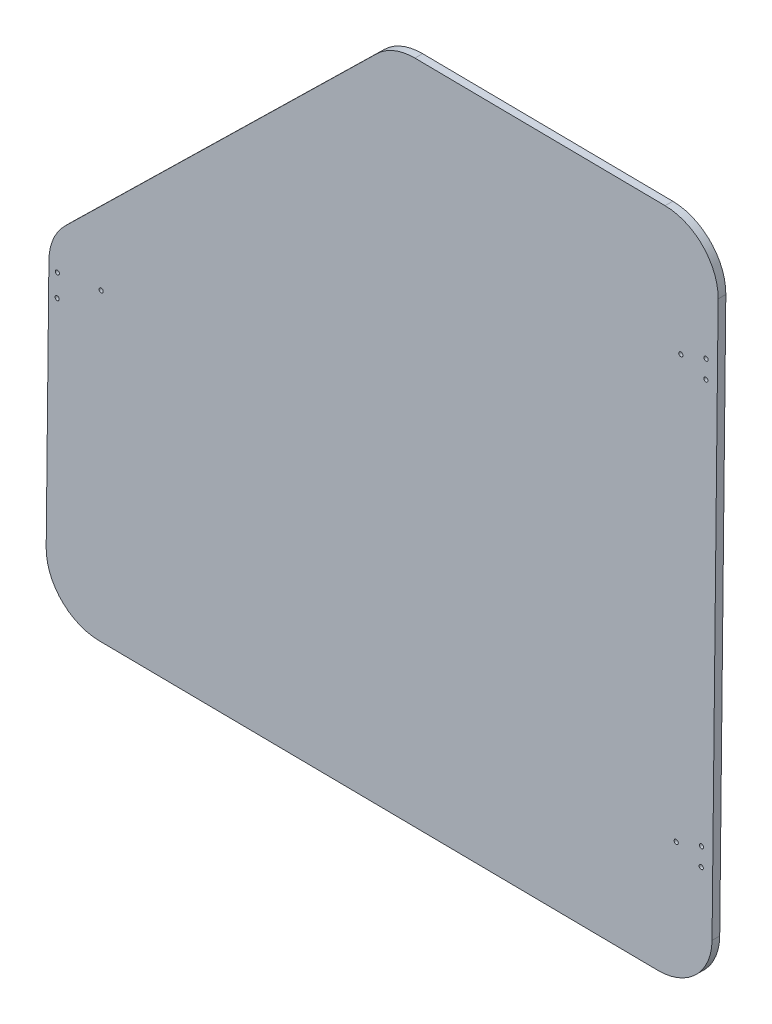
SolidWorks part; units mm, degrees
ref_plane "Front Plane" through (0, 0, 0) normal (0, 0, 1) x (1, 0, 0)
ref_plane "Top Plane" through (0, 0, 0) normal (0, 1, 0) x (1, 0, 0)
ref_plane "Right Plane" through (0, 0, 0) normal (1, 0, 0) x (0, 0, -1)
sketch "Sketch1" plane through (0, 0, 0) normal (0, 0, 1) x (1, 0, 0)
  line L60 (-704.4479, 303.9144) -> (-707.5589, 19.5107)
  line L61 (-331.7296, 693.5453) -> (-686.1227, 346.8217)
  line L62 (-4.028, 707.8164) -> (-288.4317, 710.9275)
  line L63 (49.3158, 11.2313) -> (56.2616, 646.1933)
  line L64 (-647.2694, -42.1125) -> (-12.3074, -49.0583)
  arc A60 (-707.5589, 19.5107) -> (-647.2694, -42.1125) centre (-646.6026, 18.8439) ccw
  arc A61 (-686.1227, 346.8217) -> (-704.4479, 303.9144) centre (-643.4915, 303.2476) ccw
  arc A62 (-288.4317, 710.9275) -> (-331.7296, 693.5453) centre (-289.0985, 649.9711) ccw
  arc A63 (56.2616, 646.1933) -> (-4.028, 707.8164) centre (-4.6948, 646.8601) ccw
  arc A64 (-12.3074, -49.0583) -> (49.3158, 11.2313) centre (-11.6406, 11.8981) ccw
extrude "Boss-Extrude1" add sketch "Sketch1" against normal up to surface (8.7313 mm away)
sketch "Sketch2" plane through (0, 0, 0) normal (0, 0, 1) x (1, 0, 0)
  line L21 (-645.0528, 303.9144) -> (-704.4479, 303.9144) construction
  line L22 (-645.0528, 303.9144) -> (-686.1227, 346.8217) construction
  circle A0 centre (37.0214, 77.2509) radius 2.3812
  circle A1 centre (8.561, 87.8816) radius 2.3812
  circle A2 centre (37.2471, 97.8872) radius 2.3812
  circle A3 centre (42.3002, 559.8221) radius 2.3813
  circle A4 centre (42.526, 580.4583) radius 2.3813
  circle A5 centre (13.8398, 570.4528) radius 2.3813
  circle A18 centre (42.526, 580.4583) radius 4.2164 construction
  circle A19 centre (13.8398, 570.4528) radius 4.2164 construction
  circle A20 centre (42.3002, 559.8221) radius 4.2164 construction
  circle A22 centre (37.0214, 77.2509) radius 4.2164 construction
  circle A23 centre (8.561, 87.8816) radius 4.2164 construction
  circle A24 centre (37.2471, 97.8872) radius 4.2164 construction
  circle A26 centre (-695.1269, 271.2731) radius 2.3812
  circle A27 centre (-694.8491, 296.6715) radius 2.3812
  circle A28 centre (-694.8491, 296.6715) radius 3.175 construction
  circle A29 centre (-695.1269, 271.2731) radius 3.175 construction
  circle A30 centre (-645.0528, 303.9144) radius 2.3812
  dimension "D1" = 4.7625
  dimension "D2" = 4.7625
extrude "Cut-Extrude1" cut sketch "Sketch2" against normal through all
